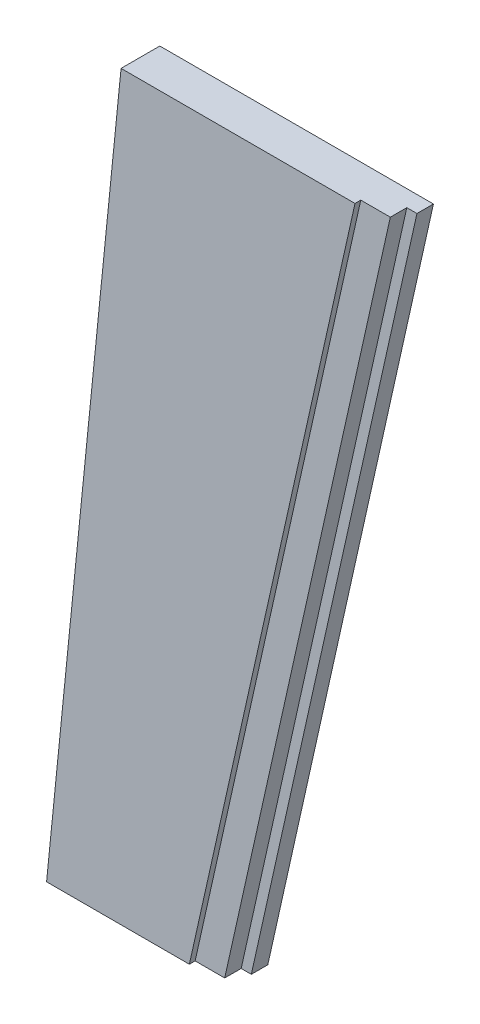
SolidWorks part; units mm, degrees
ref_plane "Спереди" through (0, 0, 0) normal (0, 0, 1) x (1, 0, 0)
ref_plane "Сверху" through (0, 0, 0) normal (0, 1, 0) x (1, 0, 0)
ref_plane "Справа" through (0, 0, 0) normal (1, 0, 0) x (0, 0, -1)
sketch "Эскиз1" plane through (0, 0, 0) normal (0, 0, 1) x (1, 0, 0)
  line L2 (-1601.0003, -900) -> (-1427.7191, -900)
  line L5 (-1226.7384, 0) -> (-1510.6033, 0)
  line L22 (-1226.7384, 0) -> (-1427.7191, -900)
  line L26 (-1510.6033, 0) -> (-1601.0003, -900)
extrude "Вытянуть1" add sketch "Эскиз1" along normal blind 47
sketch "Эскиз2" plane through (0, 0, 0) normal (0, 0, -1) x (-1, 0, 0)
  line L0 (1226.7384, 0) -> (1190.8764, 0)
  line L1 (1427.7191, -900) -> (1391.857, -900)
  line L2 (1391.857, -900) -> (1190.8764, 0)
  line L3 (1427.7191, -900) -> (1226.7384, 0) construction
  line L8 (1226.7384, 0) -> (1427.7191, -900)
  line L9 (1427.7191, -900) -> (1601.0003, -900)
  line L10 (1601.0003, -900) -> (1510.6033, 0)
  line L11 (1510.6033, 0) -> (1226.7384, 0)
  line L12 (1226.7384, 0) -> (1427.7191, -900)
  dimension "D1" = 35
  dimension "D2" = 0
extrude "Вытянуть2" add sketch "Эскиз2" against normal blind 40
sketch "Эскиз3" plane through (0, 0, 0) normal (0, 0, -1) x (-1, 0, 0)
  line L0 (1190.8764, 0) -> (1178.5808, 0)
  line L1 (1391.857, -900) -> (1379.5614, -900)
  line L2 (1379.5614, -900) -> (1178.5808, 0)
  line L3 (1190.8764, 0) -> (1391.857, -900) construction
  line L8 (1510.6033, 0) -> (1190.8764, 0)
  line L9 (1190.8764, 0) -> (1391.857, -900)
  line L10 (1391.857, -900) -> (1601.0003, -900)
  line L11 (1601.0003, -900) -> (1510.6033, 0)
  line L13 (1190.8764, 0) -> (1391.857, -900)
  dimension "D1" = 12
  dimension "D2" = 0
extrude "Вытянуть3" add sketch "Эскиз3" against normal blind 20
